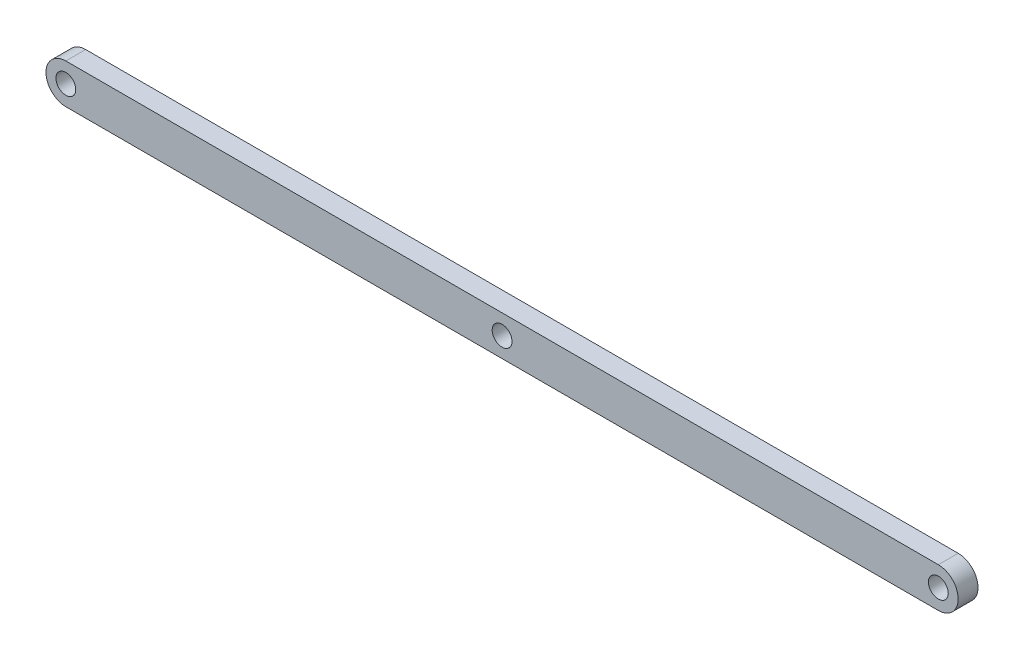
SolidWorks part; units mm, degrees
ref_plane "Front Plane" through (0, 0, 0) normal (0, 0, 1) x (1, 0, 0)
ref_plane "Top Plane" through (0, 0, 0) normal (0, 1, 0) x (1, 0, 0)
ref_plane "Right Plane" through (0, 0, 0) normal (1, 0, 0) x (0, 0, -1)
sketch "Sketch1" plane through (0, 0, 0) normal (0, 0, 1) x (1, 0, 0)
  line L0 (0, 0) -> (139.7, 0) construction
  line L1 (0, 3.175) -> (139.7, 3.175)
  line L2 (0, -3.175) -> (139.7, -3.175)
  arc A0 (0, 3.175) -> (0, -3.175) centre (0, 0) ccw
  arc A1 (139.7, -3.175) -> (139.7, 3.175) centre (139.7, 0) ccw
  circle A2 centre (0, 0) radius 1.5875
  circle A3 centre (139.7, 0) radius 1.5875
  circle A4 centre (69.85, 0) radius 1.5875
  point P3 (69.85, 0)
  dimension "D1" = 3.175
  dimension "D2" = 3.175
  dimension "D3" = 139.7
extrude "Boss-Extrude1" add sketch "Sketch1" along normal blind 3.175
